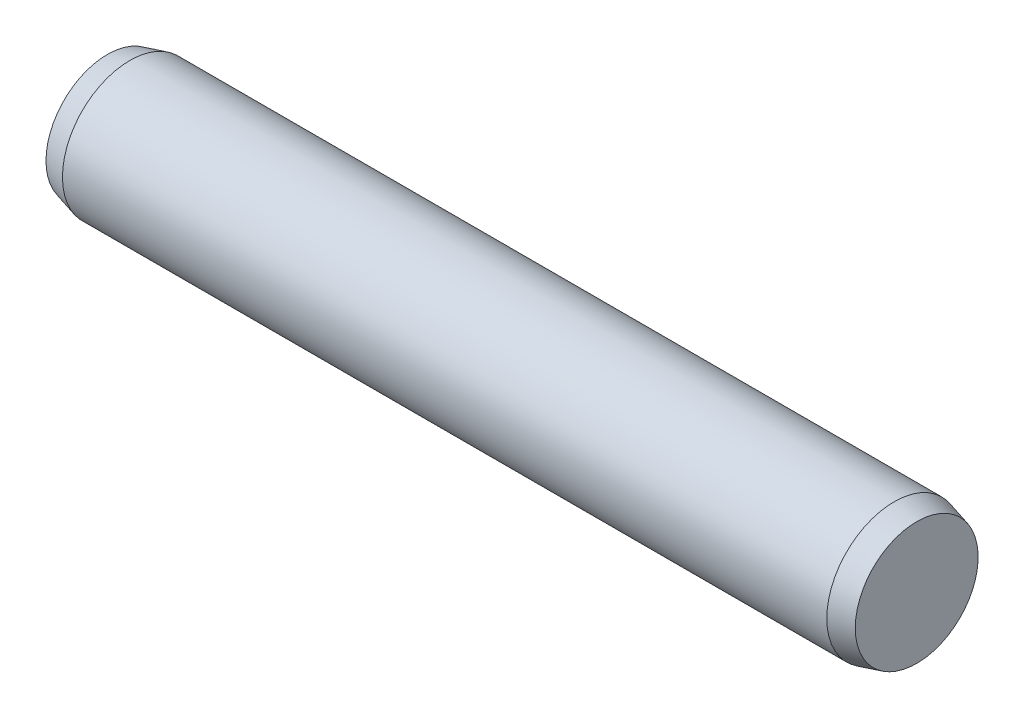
SolidWorks part; units mm, degrees
ref_plane "Plane1" through (0, 0, 0) normal (0, 0, 1) x (1, 0, 0)
ref_plane "Plane2" through (0, 0, 0) normal (0, 1, 0) x (1, 0, 0)
ref_plane "Plane3" through (0, 0, 0) normal (1, 0, 0) x (0, 0, -1)
sketch "Sketch1" plane through (0, 0, 0) normal (0, 0, 1) x (1, 0, 0)
  line L1 (-6.35, 0) -> (107.95, 0) construction
  line L2 (0, 0) -> (18, 0)
  line L3 (18, 0) -> (18, 1.366)
  line L4 (18, 1.366) -> (17.5, 1.5)
  line L5 (17.5, 1.5) -> (0.5, 1.5)
  line L6 (0, 1.366) -> (0, 0)
  line L7 (0, 1.366) -> (0.5, 1.5)
  dimension "D1" = 0.5
  dimension "D2" = 15
  dimension "D3" = 15
  dimension "Diameter" = 3
  dimension "Length" = 18
  dimension "Chamfer_len" = 0.5
revolve "Base-Revolve" add sketch "Sketch1" angle 360 about L1
equation "\"D3@Sketch1\" = 15.0"
equation "\"D1@Sketch1\" = \"Chamfer_len@Sketch1\""
equation "\"D2@Sketch1\" = \"D3@Sketch1\""
